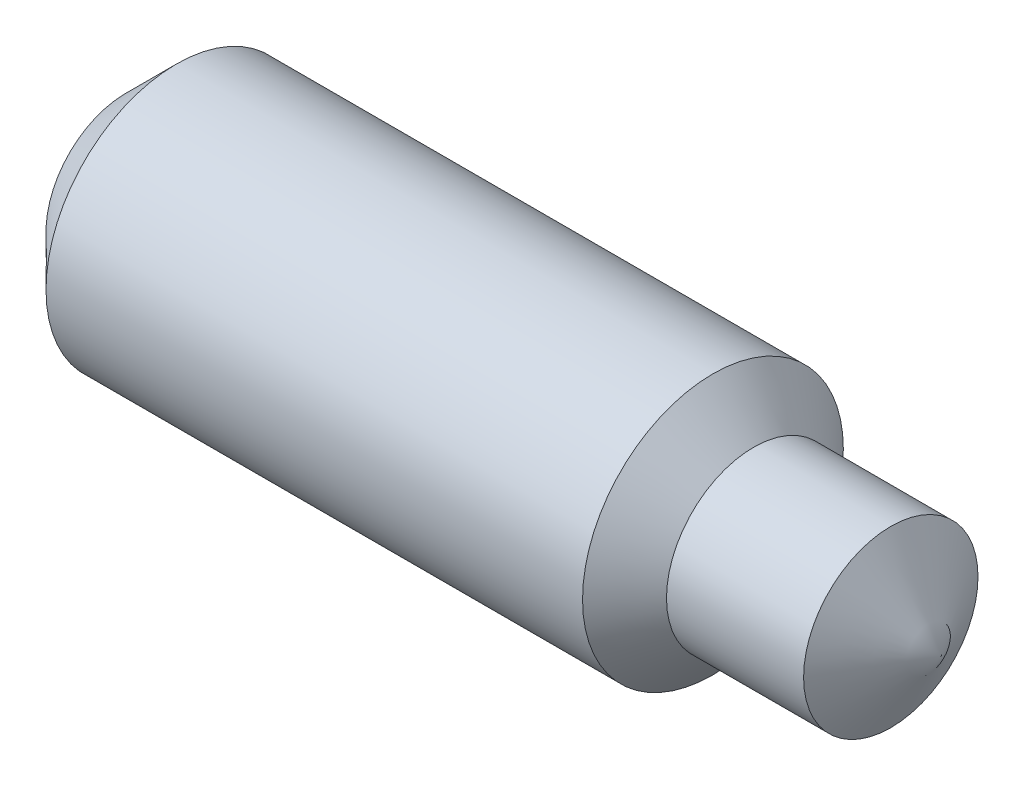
SolidWorks part; units mm, degrees
ref_plane "Front" through (0, 0, 0) normal (0, 0, 1) x (1, 0, 0)
ref_plane "Top" through (0, 0, 0) normal (0, 1, 0) x (1, 0, 0)
ref_plane "Right" through (0, 0, 0) normal (1, 0, 0) x (0, 0, -1)
sketch "Sketch1" plane through (0, 0, 0) normal (0, 0, 1) x (1, 0, 0)
  line L0 (-1.3284, 0) -> (23.5063, 0) construction
  line L1 (0, 0) -> (0, 4)
  line L2 (0, 4) -> (18, 4)
  line L3 (18, 4) -> (19.25, 2.675)
  line L4 (19.25, 2.675) -> (25, 2.675)
  line L5 (25, 0) -> (25, 2.675)
  line L6 (0, 0) -> (25, 0)
  dimension "d" = 8
  dimension "ds" = 5.35
  dimension "l" = 25
  dimension "b" = 18
  dimension "x" = 1.25
revolve "Base" add sketch "Sketch1" angle 360 about L0
chamfer "HeadChamfer" distance 1.5415 angle 45 1 edges at (0, 0, 4)
sketch "Sketch2" plane through (0, 0, 0) normal (0, 1, 0) x (1, 0, 0)
  line L0 (27.0527, 0) -> (22.5603, 0) construction
  line L2 (25, 0) -> (23.4556, 2.675)
  line L3 (25, -2.675) -> (25, 2.675) construction
  line L4 (23.4556, 2.675) -> (23.4556, 5)
  line L5 (0, 2.4585) -> (0, -2.4585) construction
  line L6 (-1.3284, 0) -> (23.5063, 0) construction
  line L8 (25, 2.675) -> (19.25, 2.675) construction
  line L9 (23.4556, 5) -> (27, 5)
  line L10 (27, 5) -> (27, 0)
  line L11 (27, 0) -> (25, 0)
  dimension "D1" = 60
  dimension "D2" = 27
  dimension "D3" = 10
revolve "Cut-Extrude3" cut sketch "Sketch2" angle 360 about L0
chamfer "Chamfer2" [suppressed] distance 1.5415 angle 45
sketch "Sketch3" plane through (0, 0, 0) normal (0, 0, 1) x (1, 0, 0)
  line L0 (0.7708, 4) -> (1.5415, 2.665)
  line L1 (1.5415, 2.665) -> (2.3123, 4)
  line L2 (2.3123, 4) -> (2.3123, 4.5)
  line L3 (2.3123, 4.5) -> (0.7708, 4.5)
  line L4 (0.7708, 4.5) -> (0.7708, 4)
  line L5 (0, 0) -> (10.4821, 0) construction
  line L7 (1.5415, 4) -> (1.5415, -4) construction
  dimension "D1" = 60
  dimension "D2" = 60
  dimension "D3" = 0.5
  dimension "D4" = 8
  dimension "D5" = 1.5415
revolve "Cut-Revolve10" [suppressed] cut sketch "Sketch3" angle 360 about L5
pattern_linear "LPattern10" [suppressed] count 10 spacing 1.8498 along (1, 0, 0)
equation "\"D1@HeadChamfer\" =  (\"d@Sketch1\" - \"D2@ThreadCosmetic1\" ) / 2 "
equation "\"D1@Chamfer2\" = \"D1@HeadChamfer\""
equation "\"D2@Sketch2\" = \"l@Sketch1\" + 2"
equation "\"D3@Sketch2\" = \"d@Sketch1\" + 2"
equation "\"D4@Sketch3\" = \"d@Sketch1\""
equation "\"D5@Sketch3\" =  ( \"d@Sketch1\" - \"D2@ThreadCosmetic1\" )  / 2"
equation "\"D3@LPattern10\" = \"D5@Sketch3\" * 1.2"
equation "\"D1@LPattern10\" = \"b@Sketch1\" / \"D3@LPattern10\""
